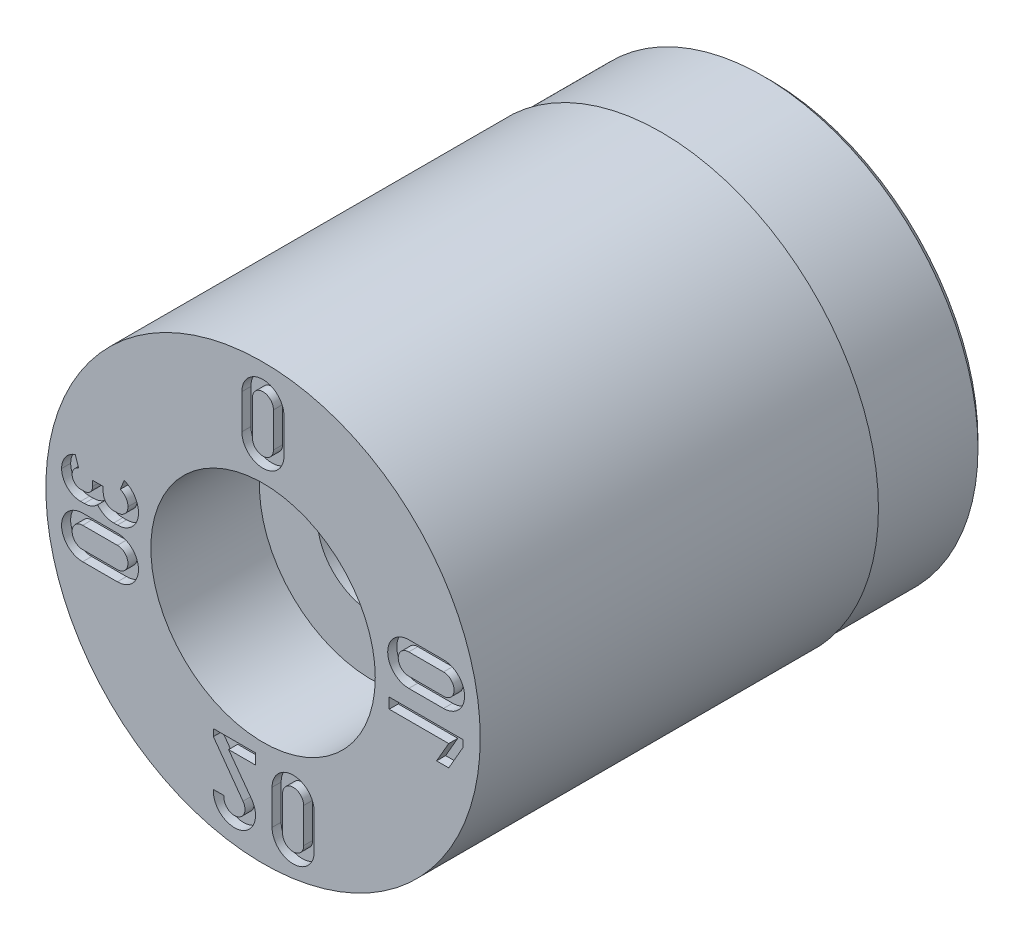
SolidWorks part; units mm, degrees
ref_plane "Front Plane" through (0, 0, 0) normal (0, 0, 1) x (1, 0, 0)
ref_plane "Top Plane" through (0, 0, 0) normal (0, 1, 0) x (1, 0, 0)
ref_plane "Right Plane" through (0, 0, 0) normal (1, 0, 0) x (0, 0, -1)
sketch "Sketch1" plane through (0, 0, 0) normal (1, 0, 0) x (0, 0, -1)
  line L2 (0, 6) -> (0, 3.1)
  line L3 (13.75, 6) -> (0, 6)
  line L4 (-3.7979, 0) -> (49996.2021, 0) construction
  line L8 (14, 1.5) -> (3, 1.5)
  line L9 (3, 3.1) -> (3, 1.5)
  line L10 (3, 3.1) -> (0, 3.1)
  line L12 (14, 1.5) -> (14, 5.75)
  line L16 (14, 5.75) -> (13.75, 6)
  dimension "D1" = 14
  dimension "D2" = 45
  dimension "D3" = 0.25
  dimension "D4" = 12
  dimension "D5" = 6.2
  dimension "D6" = 3
  dimension "D7" = 3
revolve "Revolve1" add sketch "Sketch1" angle 360 about L4
sketch "Sketch4" plane through (0, 0, 0) normal (1, 0, 0) x (0, 0, -1)
  line L0 (0, 0) -> (50000, 0) construction
  line L1 (14, -5.75) -> (14, 5.75) construction
  line L2 (11, 6.935) -> (14, 6.935)
  line L3 (11, 6.935) -> (11, 5.935)
  line L4 (11, 5.935) -> (14, 5.935)
  line L5 (14, 6.935) -> (14, 5.935)
  line L6 (13.75, 6) -> (0, 6) construction
  line L9 (0, 6.6) -> (0, -6.6) construction
  dimension "D1" = 1
  dimension "D2" = 0.065
  dimension "D3" = 11
revolve "Cut-Revolve1" cut sketch "Sketch4" angle 360 about L0
sketch "Sketch2" plane through (0, 0, 0) normal (0, 0, 1) x (1, 0, 0)
  line L805 (0.5407, -4.0484) -> (0.5408, -5.0086)
  line L806 (1.1227, -5.0086) -> (1.1227, -4.0484)
  line L807 (1.4137, -5.0085) -> (1.4138, -4.0484)
  line L808 (0.2497, -4.0485) -> (0.2497, -5.0086)
  line L809 (-4.0223, 0.3796) -> (-4.1241, 0.3796)
  line L810 (-4.415, 0.6705) -> (-4.415, 0.816)
  line L811 (-4.415, 0.816) -> (-4.706, 0.816)
  line L812 (-4.706, 0.816) -> (-4.706, 0.6706)
  line L813 (-4.9388, 0.4379) -> (-5.0406, 0.4379)
  line L814 (-5.0953, 0.9187) -> (-5.1884, 1.1944)
  line L815 (-5.0406, 0.1469) -> (-4.9388, 0.1469)
  line L816 (-4.1241, 0.0886) -> (-4.0223, 0.0886)
  line L817 (-3.8363, 1.2525) -> (-3.9431, 0.9819)
  line L818 (4.9856, 1.3692) -> (4.0254, 1.3693)
  line L819 (4.0255, 0.2053) -> (4.9857, 0.2054)
  line L820 (4.0255, 0.4963) -> (4.9856, 0.4964)
  line L821 (4.9856, 1.0782) -> (4.0254, 1.0783)
  line L822 (5.5219, -0.2715) -> (5.5219, -0.463)
  line L823 (5.5219, -0.463) -> (5.1302, -1.1444)
  line L824 (5.1302, -1.1444) -> (4.7946, -1.1444)
  line L825 (4.7946, -1.1444) -> (5.1291, -0.5624)
  line L826 (5.1291, -0.5624) -> (3.4853, -0.5626)
  line L827 (3.4853, -0.5626) -> (3.4852, -0.2717)
  line L828 (3.4852, -0.2717) -> (5.5219, -0.2715)
  line L829 (-0.2083, -3.7461) -> (-0.2083, -3.455)
  line L830 (-0.2083, -3.455) -> (-1.3721, -3.4551)
  line L831 (-1.3721, -3.4551) -> (-1.3721, -3.6476)
  line L832 (-1.3721, -3.6476) -> (-0.5538, -4.7834)
  line L833 (-1.0777, -4.9099) -> (-1.3704, -4.9099)
  line L834 (-0.3174, -4.6131) -> (-0.9503, -3.7461)
  line L835 (-0.9503, -3.7461) -> (-0.2083, -3.7461)
  line L836 (-0.5855, 4.9987) -> (-0.5854, 4.0385)
  line L837 (0.5786, 4.0386) -> (0.5787, 4.9988)
  line L838 (0.2876, 4.0386) -> (0.2875, 4.9988)
  line L839 (-0.2943, 4.9987) -> (-0.2944, 4.0385)
  line L840 (-4.0231, -0.9788) -> (-4.9832, -0.9785)
  line L841 (-4.9832, -0.3967) -> (-4.023, -0.3966)
  line L842 (-4.9831, -0.1056) -> (-4.023, -0.1057)
  line L843 (-4.0231, -1.2697) -> (-4.9832, -1.2696)
  arc A378 (1.1227, -4.0484) -> (0.5407, -4.0484) centre (0.8317, -4.0484) ccw
  arc A379 (0.5408, -5.0086) -> (1.1227, -5.0086) centre (0.8317, -5.0086) ccw
  arc A380 (1.4138, -4.0484) -> (0.2497, -4.0485) centre (0.8317, -4.0484) ccw
  arc A381 (0.2497, -5.0086) -> (1.4137, -5.0085) centre (0.8317, -5.0086) ccw
  arc A382 (-3.7313, 0.6706) -> (-3.9431, 0.9819) centre (-4.066, 0.6706) ccw
  arc A383 (-4.0223, 0.3796) -> (-3.7313, 0.6706) centre (-4.0223, 0.6706) ccw
  arc A384 (-4.415, 0.6705) -> (-4.1241, 0.3796) centre (-4.1241, 0.6705) ccw
  arc A385 (-4.9388, 0.4379) -> (-4.706, 0.6706) centre (-4.9387, 0.6706) ccw
  arc A386 (-5.2733, 0.6707) -> (-5.0406, 0.4379) centre (-5.0403, 0.6709) ccw
  arc A387 (-5.0953, 0.9187) -> (-5.2733, 0.6707) centre (-5.0118, 0.6709) ccw
  arc A388 (-5.1884, 1.1944) -> (-5.5643, 0.6707) centre (-5.0113, 0.6706) ccw
  arc A389 (-5.5643, 0.6707) -> (-5.0406, 0.1469) centre (-5.0406, 0.6706) ccw
  arc A390 (-4.9388, 0.1469) -> (-4.571, 0.2978) centre (-4.9387, 0.6704) ccw
  arc A391 (-4.571, 0.2978) -> (-4.1241, 0.0886) centre (-4.1242, 0.6703) ccw
  arc A392 (-4.0223, 0.0886) -> (-3.4404, 0.6705) centre (-4.0222, 0.6705) ccw
  arc A393 (-3.4404, 0.6705) -> (-3.8363, 1.2525) centre (-4.0661, 0.6704) ccw
  arc A394 (4.0254, 1.3693) -> (4.0255, 0.2053) centre (4.0255, 0.7873) ccw
  arc A395 (4.9857, 0.2054) -> (4.9856, 1.3692) centre (4.9856, 0.7873) ccw
  arc A396 (4.0254, 1.0783) -> (4.0255, 0.4963) centre (4.0255, 0.7873) ccw
  arc A397 (4.9856, 0.4964) -> (4.9856, 1.0782) centre (4.9856, 0.7873) ccw
  arc A398 (-1.0777, -4.9099) -> (-0.5538, -4.7834) centre (-0.79, -4.9535) ccw
  arc A399 (-1.3704, -4.9099) -> (-0.3174, -4.6131) centre (-0.7898, -4.9532) ccw
  arc A400 (-0.5854, 4.0385) -> (0.5786, 4.0386) centre (-0.0034, 4.0386) ccw
  arc A401 (0.5787, 4.9988) -> (-0.5855, 4.9987) centre (-0.0034, 4.9987) ccw
  arc A402 (-0.2944, 4.0385) -> (0.2876, 4.0386) centre (-0.0034, 4.0386) ccw
  arc A403 (0.2875, 4.9988) -> (-0.2943, 4.9987) centre (-0.0034, 4.9987) ccw
  arc A404 (-4.0231, -0.9788) -> (-4.023, -0.3966) centre (-4.023, -0.6877) ccw
  arc A405 (-4.9832, -0.3967) -> (-4.9832, -0.9785) centre (-4.9832, -0.6876) ccw
  arc A406 (-4.0231, -1.2697) -> (-4.023, -0.1057) centre (-4.023, -0.6877) ccw
  arc A407 (-4.9831, -0.1056) -> (-4.9832, -1.2696) centre (-4.9832, -0.6876) ccw
  point P1556 (0, 0.0094)
  point P1557 (0.0094, 0.0094)
  point P1558 (0.0094, 0)
extrude "Cut-Extrude1" cut sketch "Sketch2" against normal blind 0.25
